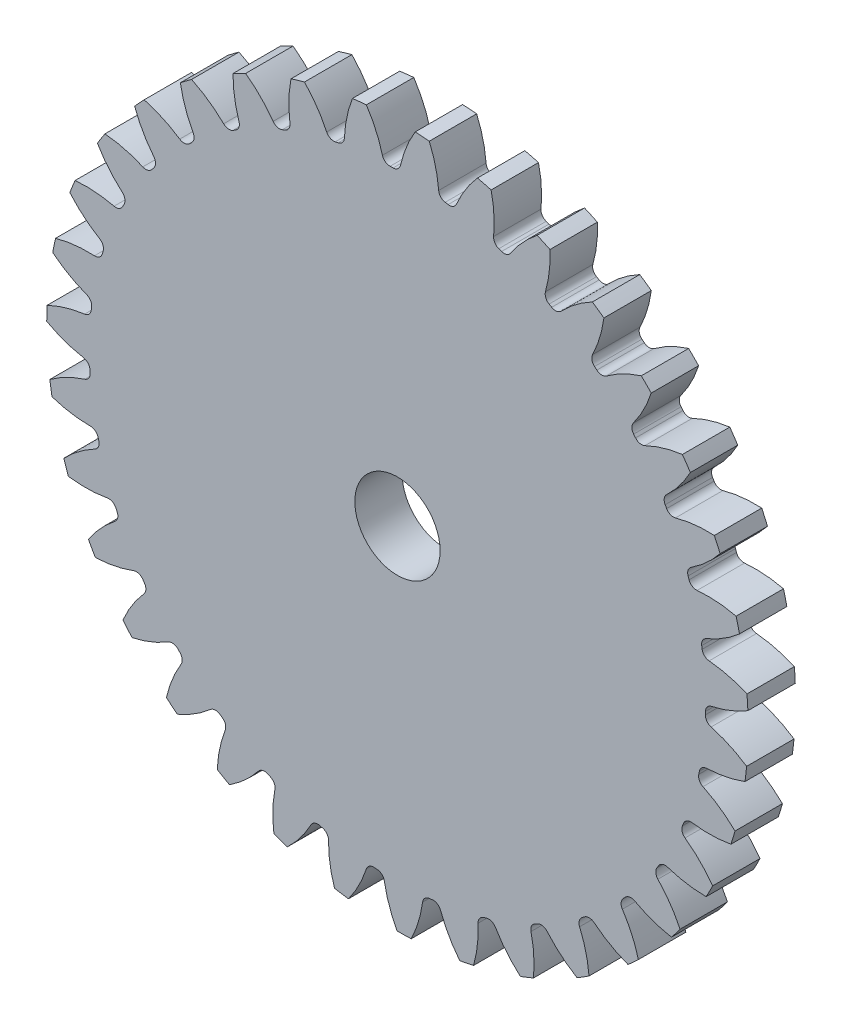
SolidWorks part; units mm, degrees
ref_plane "Front" through (0, 0, 0) normal (0, 0, 1) x (1, 0, 0)
ref_plane "Top" through (0, 0, 0) normal (0, 1, 0) x (1, 0, 0)
ref_plane "Right" through (0, 0, 0) normal (1, 0, 0) x (0, 0, -1)
sketch "Sketch3" plane through (0, 0, 0) normal (0, 0, 1) x (1, 0, 0)
  circle A0 centre (0, 0) radius 939.8
  dimension "od" = 1879.6
extrude "gearBody" add sketch "Sketch3" along normal blind 127
sketch "Sketch2" plane through (0, 0, 0) normal (0, 0, 1) x (1, 0, 0)
  line L0 (0, 0) -> (771.7967, 319.6887) construction
  line L1 (936.4002, -90.1273) -> (0, 0) construction
  line L2 (0, 0) -> (36.3143, 0) construction
  line L3 (888.8421, 16.7566) -> (886.7983, -62.5281) construction
  line L5 (887.8202, -22.8857) -> (0, 0) construction
  line L7 (0, 0) -> (835.3867, 0) construction
  arc A0 (835.3859, 1.2175) -> (834.2137, -44.2555) centre (0, 0) ccw construction
  arc A1 (938.8956, 41.2189) -> (935.5251, -89.5367) centre (0, 0) ccw construction
  arc A2 (888.8421, 16.7566) -> (886.7983, -62.5281) centre (0, 0) ccw construction
  arc A3 (825.1124, -25.2935) -> (825.3197, -17.2504) centre (0, 0) ccw
  arc A4 (936.4002, -90.1273) -> (840.303, -45.8645) centre (754.3011, -359.0276) ccw
  arc A5 (936.4002, -90.1273) -> (939.8, 41.7636) centre (0, 0) ccw
  arc A6 (939.8, 41.7636) -> (841.55, 2.5106) centre (771.7967, 319.6887) cw
  arc A7 (825.3197, -17.2504) -> (841.55, 2.5106) centre (845.9908, -17.6824) cw
  arc A8 (840.303, -45.8645) -> (825.1124, -25.2935) centre (845.7783, -25.927) cw
  point P6 (939.8, 41.7636)
  point P22 (936.4002, -90.1273)
  dimension "baseDia" = 1670.7735
  dimension "od" = 1879.6
  dimension "pd" = 1778
  dimension "rd" = 1651
  dimension "rFillet" = 20.6756
  dimension "pointX" = 939.8
  dimension "pointY" = 41.7636
  dimension "CTT" = 79.2847
  dimension "flankCenterAngle" = 22.5
extrude "toothCut" cut sketch "Sketch2" along normal through all
pattern_circular "CirPattern1" count 35 over 360 about axis through (0, 0, 0) along (0, 0, 1) of "toothCut"
sketch "hub1Dia" plane through (0, 0, 0) normal (0, 0, -1) x (-1, 0, 0)
  circle A0 centre (0, 0) radius 12.7
  dimension "hub1Dia" = 25.4
sketch "hub2Dia" plane through (0, 0, 127) normal (0, 0, 1) x (1, 0, 0)
  circle A0 centre (0, 0) radius 12.7
  dimension "hub2dia" = 25.4
sketch "boreDia" plane through (0, 0, 0) normal (0, 0, 1) x (1, 0, 0)
  circle A0 centre (0, 0) radius 114.3
  dimension "boreDia" = 228.6
extrude "bore" cut sketch "boreDia" against normal mid plane 25400
